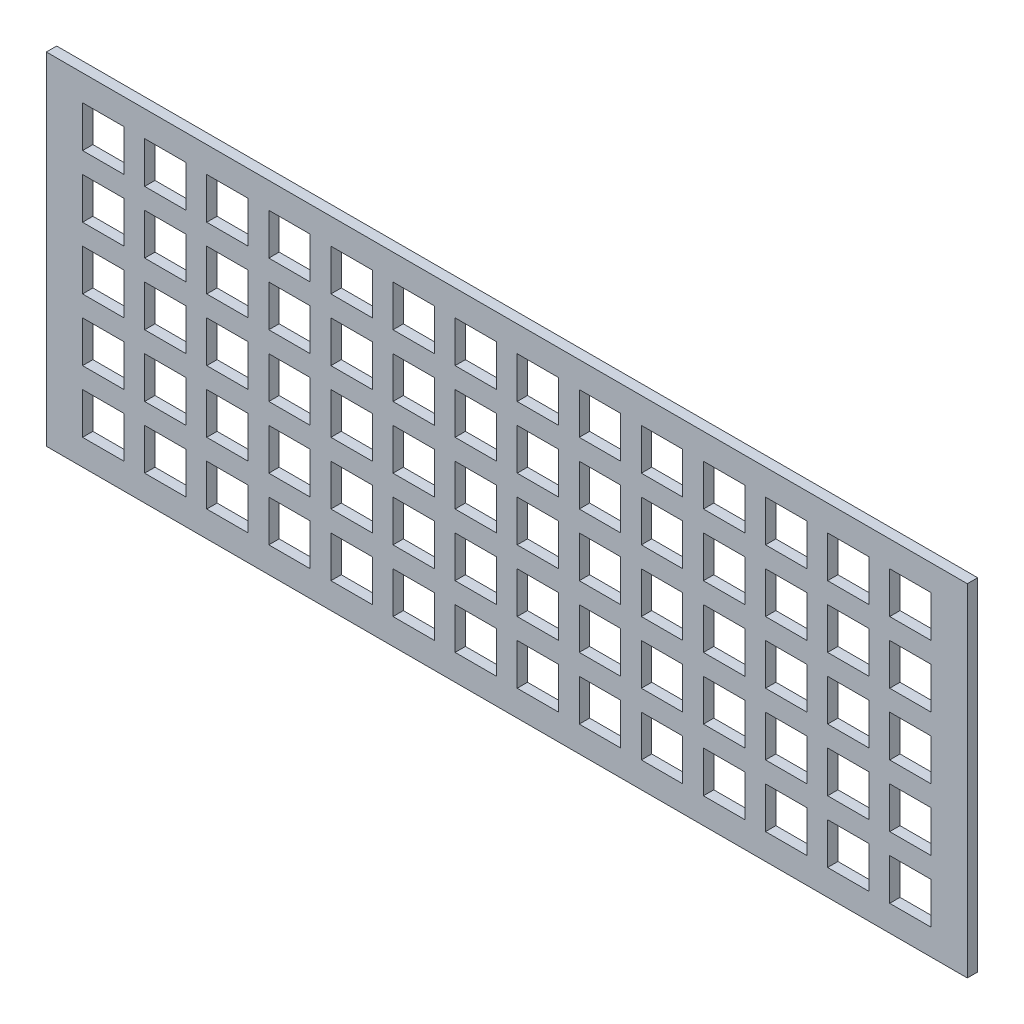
SolidWorks part; units mm, degrees
ref_plane "Front Plane" through (0, 0, 0) normal (0, 0, 1) x (1, 0, 0)
ref_plane "Top Plane" through (0, 0, 0) normal (0, 1, 0) x (1, 0, 0)
ref_plane "Right Plane" through (0, 0, 0) normal (1, 0, 0) x (0, 0, -1)
sketch "Sketch1" plane through (0, 0, 0) normal (0, 0, 1) x (1, 0, 0)
  line L1 (-141.2875, 52.3875) -> (141.2875, 52.3875)
  line L2 (-141.2875, 52.3875) -> (-141.2875, -52.3875)
  line L3 (-141.2875, -52.3875) -> (141.2875, -52.3875)
  line L4 (141.2875, 52.3875) -> (141.2875, -52.3875)
  line L5 (-141.2875, 52.3875) -> (141.2875, -52.3875) construction
  line L6 (-141.2875, -52.3875) -> (141.2875, 52.3875) construction
  point P0 (0, 0)
  dimension "D1" = 282.575
  dimension "D2" = 104.775
extrude "Boss-Extrude1" add sketch "Sketch1" along normal blind 3.175
sketch "Sketch3" plane through (0, 0, 3.175) normal (0, 0, 1) x (1, 0, 0)
  line L0 (-141.2875, -52.3875) -> (141.2875, -52.3875) construction
  line L1 (-130.175, -31.75) -> (-117.475, -31.75)
  line L2 (-130.175, -31.75) -> (-130.175, -44.45)
  line L3 (-130.175, -44.45) -> (-117.475, -44.45)
  line L4 (-117.475, -31.75) -> (-117.475, -44.45)
  line L5 (-130.175, -31.75) -> (-117.475, -44.45) construction
  line L6 (-130.175, -44.45) -> (-117.475, -31.75) construction
  line L7 (-141.2875, 52.3875) -> (-141.2875, -52.3875) construction
  line L8 (-111.125, -44.45) -> (-98.425, -44.45)
  line L9 (-98.425, -31.75) -> (-98.425, -44.45)
  line L10 (-111.125, -31.75) -> (-98.425, -31.75)
  line L11 (-111.125, -31.75) -> (-111.125, -44.45)
  line L12 (-92.075, -44.45) -> (-79.375, -44.45)
  line L13 (-79.375, -31.75) -> (-79.375, -44.45)
  line L14 (-92.075, -31.75) -> (-79.375, -31.75)
  line L15 (-92.075, -31.75) -> (-92.075, -44.45)
  line L16 (-73.025, -44.45) -> (-60.325, -44.45)
  line L17 (-60.325, -31.75) -> (-60.325, -44.45)
  line L18 (-73.025, -31.75) -> (-60.325, -31.75)
  line L19 (-73.025, -31.75) -> (-73.025, -44.45)
  line L20 (-53.975, -44.45) -> (-41.275, -44.45)
  line L21 (-41.275, -31.75) -> (-41.275, -44.45)
  line L22 (-53.975, -31.75) -> (-41.275, -31.75)
  line L23 (-53.975, -31.75) -> (-53.975, -44.45)
  line L24 (-34.925, -44.45) -> (-22.225, -44.45)
  line L25 (-22.225, -31.75) -> (-22.225, -44.45)
  line L26 (-34.925, -31.75) -> (-22.225, -31.75)
  line L27 (-34.925, -31.75) -> (-34.925, -44.45)
  line L28 (-111.125, -25.4) -> (-98.425, -25.4)
  line L29 (-98.425, -12.7) -> (-98.425, -25.4)
  line L30 (-111.125, -12.7) -> (-98.425, -12.7)
  line L31 (-111.125, -12.7) -> (-111.125, -25.4)
  line L32 (-92.075, -25.4) -> (-79.375, -25.4)
  line L33 (-79.375, -12.7) -> (-79.375, -25.4)
  line L34 (-92.075, -12.7) -> (-79.375, -12.7)
  line L35 (-92.075, -12.7) -> (-92.075, -25.4)
  line L36 (-73.025, -25.4) -> (-60.325, -25.4)
  line L37 (-60.325, -12.7) -> (-60.325, -25.4)
  line L38 (-73.025, -12.7) -> (-60.325, -12.7)
  line L39 (-73.025, -12.7) -> (-73.025, -25.4)
  line L40 (-53.975, -25.4) -> (-41.275, -25.4)
  line L41 (-41.275, -12.7) -> (-41.275, -25.4)
  line L42 (-53.975, -12.7) -> (-41.275, -12.7)
  line L43 (-53.975, -12.7) -> (-53.975, -25.4)
  line L44 (-34.925, -25.4) -> (-22.225, -25.4)
  line L45 (-22.225, -12.7) -> (-22.225, -25.4)
  line L46 (-34.925, -12.7) -> (-22.225, -12.7)
  line L47 (-34.925, -12.7) -> (-34.925, -25.4)
  line L48 (-111.125, -6.35) -> (-98.425, -6.35)
  line L49 (-98.425, 6.35) -> (-98.425, -6.35)
  line L50 (-111.125, 6.35) -> (-98.425, 6.35)
  line L51 (-111.125, 6.35) -> (-111.125, -6.35)
  line L52 (-92.075, -6.35) -> (-79.375, -6.35)
  line L53 (-79.375, 6.35) -> (-79.375, -6.35)
  line L54 (-92.075, 6.35) -> (-79.375, 6.35)
  line L55 (-92.075, 6.35) -> (-92.075, -6.35)
  line L56 (-73.025, -6.35) -> (-60.325, -6.35)
  line L57 (-60.325, 6.35) -> (-60.325, -6.35)
  line L58 (-73.025, 6.35) -> (-60.325, 6.35)
  line L59 (-73.025, 6.35) -> (-73.025, -6.35)
  line L60 (-53.975, -6.35) -> (-41.275, -6.35)
  line L61 (-41.275, 6.35) -> (-41.275, -6.35)
  line L62 (-53.975, 6.35) -> (-41.275, 6.35)
  line L63 (-53.975, 6.35) -> (-53.975, -6.35)
  line L64 (-34.925, -6.35) -> (-22.225, -6.35)
  line L65 (-22.225, 6.35) -> (-22.225, -6.35)
  line L66 (-34.925, 6.35) -> (-22.225, 6.35)
  line L67 (-34.925, 6.35) -> (-34.925, -6.35)
  line L68 (-111.125, 12.7) -> (-98.425, 12.7)
  line L69 (-98.425, 25.4) -> (-98.425, 12.7)
  line L70 (-111.125, 25.4) -> (-98.425, 25.4)
  line L71 (-111.125, 25.4) -> (-111.125, 12.7)
  line L72 (-92.075, 12.7) -> (-79.375, 12.7)
  line L73 (-79.375, 25.4) -> (-79.375, 12.7)
  line L74 (-92.075, 25.4) -> (-79.375, 25.4)
  line L75 (-92.075, 25.4) -> (-92.075, 12.7)
  line L76 (-73.025, 12.7) -> (-60.325, 12.7)
  line L77 (-60.325, 25.4) -> (-60.325, 12.7)
  line L78 (-73.025, 25.4) -> (-60.325, 25.4)
  line L79 (-73.025, 25.4) -> (-73.025, 12.7)
  line L80 (-53.975, 12.7) -> (-41.275, 12.7)
  line L81 (-41.275, 25.4) -> (-41.275, 12.7)
  line L82 (-53.975, 25.4) -> (-41.275, 25.4)
  line L83 (-53.975, 25.4) -> (-53.975, 12.7)
  line L84 (-34.925, 12.7) -> (-22.225, 12.7)
  line L85 (-22.225, 25.4) -> (-22.225, 12.7)
  line L86 (-34.925, 25.4) -> (-22.225, 25.4)
  line L87 (-34.925, 25.4) -> (-34.925, 12.7)
  line L88 (-111.125, 31.75) -> (-98.425, 31.75)
  line L89 (-98.425, 44.45) -> (-98.425, 31.75)
  line L90 (-111.125, 44.45) -> (-98.425, 44.45)
  line L91 (-111.125, 44.45) -> (-111.125, 31.75)
  line L92 (-92.075, 31.75) -> (-79.375, 31.75)
  line L93 (-79.375, 44.45) -> (-79.375, 31.75)
  line L94 (-92.075, 44.45) -> (-79.375, 44.45)
  line L95 (-92.075, 44.45) -> (-92.075, 31.75)
  line L96 (-73.025, 31.75) -> (-60.325, 31.75)
  line L97 (-60.325, 44.45) -> (-60.325, 31.75)
  line L98 (-73.025, 44.45) -> (-60.325, 44.45)
  line L99 (-73.025, 44.45) -> (-73.025, 31.75)
  line L100 (-53.975, 31.75) -> (-41.275, 31.75)
  line L101 (-41.275, 44.45) -> (-41.275, 31.75)
  line L102 (-53.975, 44.45) -> (-41.275, 44.45)
  line L103 (-53.975, 44.45) -> (-53.975, 31.75)
  line L104 (-34.925, 31.75) -> (-22.225, 31.75)
  line L105 (-22.225, 44.45) -> (-22.225, 31.75)
  line L106 (-34.925, 44.45) -> (-22.225, 44.45)
  line L107 (-34.925, 44.45) -> (-34.925, 31.75)
  line L108 (-130.175, -25.4) -> (-117.475, -25.4)
  line L109 (-117.475, -12.7) -> (-117.475, -25.4)
  line L110 (-130.175, -12.7) -> (-117.475, -12.7)
  line L111 (-130.175, -12.7) -> (-130.175, -25.4)
  line L112 (-130.175, -6.35) -> (-117.475, -6.35)
  line L113 (-117.475, 6.35) -> (-117.475, -6.35)
  line L114 (-130.175, 6.35) -> (-117.475, 6.35)
  line L115 (-130.175, 6.35) -> (-130.175, -6.35)
  line L116 (-130.175, 12.7) -> (-117.475, 12.7)
  line L117 (-117.475, 25.4) -> (-117.475, 12.7)
  line L118 (-130.175, 25.4) -> (-117.475, 25.4)
  line L119 (-130.175, 25.4) -> (-130.175, 12.7)
  line L120 (-130.175, 31.75) -> (-117.475, 31.75)
  line L121 (-117.475, 44.45) -> (-117.475, 31.75)
  line L122 (-130.175, 44.45) -> (-117.475, 44.45)
  line L123 (-130.175, 44.45) -> (-130.175, 31.75)
  line L124 (-15.875, -44.45) -> (-3.175, -44.45)
  line L125 (-3.175, -31.75) -> (-3.175, -44.45)
  line L126 (-15.875, -31.75) -> (-3.175, -31.75)
  line L127 (-15.875, -31.75) -> (-15.875, -44.45)
  line L128 (3.175, -44.45) -> (15.875, -44.45)
  line L129 (15.875, -31.75) -> (15.875, -44.45)
  line L130 (3.175, -31.75) -> (15.875, -31.75)
  line L131 (3.175, -31.75) -> (3.175, -44.45)
  line L132 (22.225, -44.45) -> (34.925, -44.45)
  line L133 (34.925, -31.75) -> (34.925, -44.45)
  line L134 (22.225, -31.75) -> (34.925, -31.75)
  line L135 (22.225, -31.75) -> (22.225, -44.45)
  line L136 (41.275, -44.45) -> (53.975, -44.45)
  line L137 (53.975, -31.75) -> (53.975, -44.45)
  line L138 (41.275, -31.75) -> (53.975, -31.75)
  line L139 (41.275, -31.75) -> (41.275, -44.45)
  line L140 (60.325, -44.45) -> (73.025, -44.45)
  line L141 (73.025, -31.75) -> (73.025, -44.45)
  line L142 (60.325, -31.75) -> (73.025, -31.75)
  line L143 (60.325, -31.75) -> (60.325, -44.45)
  line L144 (79.375, -44.45) -> (92.075, -44.45)
  line L145 (92.075, -31.75) -> (92.075, -44.45)
  line L146 (79.375, -31.75) -> (92.075, -31.75)
  line L147 (79.375, -31.75) -> (79.375, -44.45)
  line L148 (98.425, -44.45) -> (111.125, -44.45)
  line L149 (111.125, -31.75) -> (111.125, -44.45)
  line L150 (98.425, -31.75) -> (111.125, -31.75)
  line L151 (98.425, -31.75) -> (98.425, -44.45)
  line L152 (117.475, -44.45) -> (130.175, -44.45)
  line L153 (130.175, -31.75) -> (130.175, -44.45)
  line L154 (117.475, -31.75) -> (130.175, -31.75)
  line L155 (117.475, -31.75) -> (117.475, -44.45)
  line L160 (-15.875, -25.4) -> (-3.175, -25.4)
  line L161 (-3.175, -12.7) -> (-3.175, -25.4)
  line L162 (-15.875, -12.7) -> (-3.175, -12.7)
  line L163 (-15.875, -12.7) -> (-15.875, -25.4)
  line L164 (3.175, -25.4) -> (15.875, -25.4)
  line L165 (15.875, -12.7) -> (15.875, -25.4)
  line L166 (3.175, -12.7) -> (15.875, -12.7)
  line L167 (3.175, -12.7) -> (3.175, -25.4)
  line L168 (22.225, -25.4) -> (34.925, -25.4)
  line L169 (34.925, -12.7) -> (34.925, -25.4)
  line L170 (22.225, -12.7) -> (34.925, -12.7)
  line L171 (22.225, -12.7) -> (22.225, -25.4)
  line L172 (41.275, -25.4) -> (53.975, -25.4)
  line L173 (53.975, -12.7) -> (53.975, -25.4)
  line L174 (41.275, -12.7) -> (53.975, -12.7)
  line L175 (41.275, -12.7) -> (41.275, -25.4)
  line L176 (60.325, -25.4) -> (73.025, -25.4)
  line L177 (73.025, -12.7) -> (73.025, -25.4)
  line L178 (60.325, -12.7) -> (73.025, -12.7)
  line L179 (60.325, -12.7) -> (60.325, -25.4)
  line L180 (79.375, -25.4) -> (92.075, -25.4)
  line L181 (92.075, -12.7) -> (92.075, -25.4)
  line L182 (79.375, -12.7) -> (92.075, -12.7)
  line L183 (79.375, -12.7) -> (79.375, -25.4)
  line L184 (98.425, -25.4) -> (111.125, -25.4)
  line L185 (111.125, -12.7) -> (111.125, -25.4)
  line L186 (98.425, -12.7) -> (111.125, -12.7)
  line L187 (98.425, -12.7) -> (98.425, -25.4)
  line L188 (117.475, -25.4) -> (130.175, -25.4)
  line L189 (130.175, -12.7) -> (130.175, -25.4)
  line L190 (117.475, -12.7) -> (130.175, -12.7)
  line L191 (117.475, -12.7) -> (117.475, -25.4)
  line L196 (-15.875, -6.35) -> (-3.175, -6.35)
  line L197 (-3.175, 6.35) -> (-3.175, -6.35)
  line L198 (-15.875, 6.35) -> (-3.175, 6.35)
  line L199 (-15.875, 6.35) -> (-15.875, -6.35)
  line L200 (3.175, -6.35) -> (15.875, -6.35)
  line L201 (15.875, 6.35) -> (15.875, -6.35)
  line L202 (3.175, 6.35) -> (15.875, 6.35)
  line L203 (3.175, 6.35) -> (3.175, -6.35)
  line L204 (22.225, -6.35) -> (34.925, -6.35)
  line L205 (34.925, 6.35) -> (34.925, -6.35)
  line L206 (22.225, 6.35) -> (34.925, 6.35)
  line L207 (22.225, 6.35) -> (22.225, -6.35)
  line L208 (41.275, -6.35) -> (53.975, -6.35)
  line L209 (53.975, 6.35) -> (53.975, -6.35)
  line L210 (41.275, 6.35) -> (53.975, 6.35)
  line L211 (41.275, 6.35) -> (41.275, -6.35)
  line L212 (60.325, -6.35) -> (73.025, -6.35)
  line L213 (73.025, 6.35) -> (73.025, -6.35)
  line L214 (60.325, 6.35) -> (73.025, 6.35)
  line L215 (60.325, 6.35) -> (60.325, -6.35)
  line L216 (79.375, -6.35) -> (92.075, -6.35)
  line L217 (92.075, 6.35) -> (92.075, -6.35)
  line L218 (79.375, 6.35) -> (92.075, 6.35)
  line L219 (79.375, 6.35) -> (79.375, -6.35)
  line L220 (98.425, -6.35) -> (111.125, -6.35)
  line L221 (111.125, 6.35) -> (111.125, -6.35)
  line L222 (98.425, 6.35) -> (111.125, 6.35)
  line L223 (98.425, 6.35) -> (98.425, -6.35)
  line L224 (117.475, -6.35) -> (130.175, -6.35)
  line L225 (130.175, 6.35) -> (130.175, -6.35)
  line L226 (117.475, 6.35) -> (130.175, 6.35)
  line L227 (117.475, 6.35) -> (117.475, -6.35)
  line L232 (-15.875, 12.7) -> (-3.175, 12.7)
  line L233 (-3.175, 25.4) -> (-3.175, 12.7)
  line L234 (-15.875, 25.4) -> (-3.175, 25.4)
  line L235 (-15.875, 25.4) -> (-15.875, 12.7)
  line L236 (3.175, 12.7) -> (15.875, 12.7)
  line L237 (15.875, 25.4) -> (15.875, 12.7)
  line L238 (3.175, 25.4) -> (15.875, 25.4)
  line L239 (3.175, 25.4) -> (3.175, 12.7)
  line L240 (22.225, 12.7) -> (34.925, 12.7)
  line L241 (34.925, 25.4) -> (34.925, 12.7)
  line L242 (22.225, 25.4) -> (34.925, 25.4)
  line L243 (22.225, 25.4) -> (22.225, 12.7)
  line L244 (41.275, 12.7) -> (53.975, 12.7)
  line L245 (53.975, 25.4) -> (53.975, 12.7)
  line L246 (41.275, 25.4) -> (53.975, 25.4)
  line L247 (41.275, 25.4) -> (41.275, 12.7)
  line L248 (60.325, 12.7) -> (73.025, 12.7)
  line L249 (73.025, 25.4) -> (73.025, 12.7)
  line L250 (60.325, 25.4) -> (73.025, 25.4)
  line L251 (60.325, 25.4) -> (60.325, 12.7)
  line L252 (79.375, 12.7) -> (92.075, 12.7)
  line L253 (92.075, 25.4) -> (92.075, 12.7)
  line L254 (79.375, 25.4) -> (92.075, 25.4)
  line L255 (79.375, 25.4) -> (79.375, 12.7)
  line L256 (98.425, 12.7) -> (111.125, 12.7)
  line L257 (111.125, 25.4) -> (111.125, 12.7)
  line L258 (98.425, 25.4) -> (111.125, 25.4)
  line L259 (98.425, 25.4) -> (98.425, 12.7)
  line L260 (117.475, 12.7) -> (130.175, 12.7)
  line L261 (130.175, 25.4) -> (130.175, 12.7)
  line L262 (117.475, 25.4) -> (130.175, 25.4)
  line L263 (117.475, 25.4) -> (117.475, 12.7)
  line L268 (-15.875, 31.75) -> (-3.175, 31.75)
  line L269 (-3.175, 44.45) -> (-3.175, 31.75)
  line L270 (-15.875, 44.45) -> (-3.175, 44.45)
  line L271 (-15.875, 44.45) -> (-15.875, 31.75)
  line L272 (3.175, 31.75) -> (15.875, 31.75)
  line L273 (15.875, 44.45) -> (15.875, 31.75)
  line L274 (3.175, 44.45) -> (15.875, 44.45)
  line L275 (3.175, 44.45) -> (3.175, 31.75)
  line L276 (22.225, 31.75) -> (34.925, 31.75)
  line L277 (34.925, 44.45) -> (34.925, 31.75)
  line L278 (22.225, 44.45) -> (34.925, 44.45)
  line L279 (22.225, 44.45) -> (22.225, 31.75)
  line L280 (41.275, 31.75) -> (53.975, 31.75)
  line L281 (53.975, 44.45) -> (53.975, 31.75)
  line L282 (41.275, 44.45) -> (53.975, 44.45)
  line L283 (41.275, 44.45) -> (41.275, 31.75)
  line L284 (60.325, 31.75) -> (73.025, 31.75)
  line L285 (73.025, 44.45) -> (73.025, 31.75)
  line L286 (60.325, 44.45) -> (73.025, 44.45)
  line L287 (60.325, 44.45) -> (60.325, 31.75)
  line L288 (79.375, 31.75) -> (92.075, 31.75)
  line L289 (92.075, 44.45) -> (92.075, 31.75)
  line L290 (79.375, 44.45) -> (92.075, 44.45)
  line L291 (79.375, 44.45) -> (79.375, 31.75)
  line L292 (98.425, 31.75) -> (111.125, 31.75)
  line L293 (111.125, 44.45) -> (111.125, 31.75)
  line L294 (98.425, 44.45) -> (111.125, 44.45)
  line L295 (98.425, 44.45) -> (98.425, 31.75)
  line L296 (117.475, 31.75) -> (130.175, 31.75)
  line L297 (130.175, 44.45) -> (130.175, 31.75)
  line L298 (117.475, 44.45) -> (130.175, 44.45)
  line L299 (117.475, 44.45) -> (117.475, 31.75)
  point P0 (-123.825, -38.1)
  point P7 (-123.825, -44.45)
  dimension "D1" = 7.9375
  dimension "D2" = 12.7
  dimension "D3" = 12.7
  dimension "D4" = 11.1125
  dimension "D5" = 14
  dimension "D6" = 5
extrude "Cut-Extrude1" cut sketch "Sketch3" against normal through all
ref_plane "Plane1" through (0, 0, 1.5875) normal (0, 0, -1) x (-1, 0, 0)
